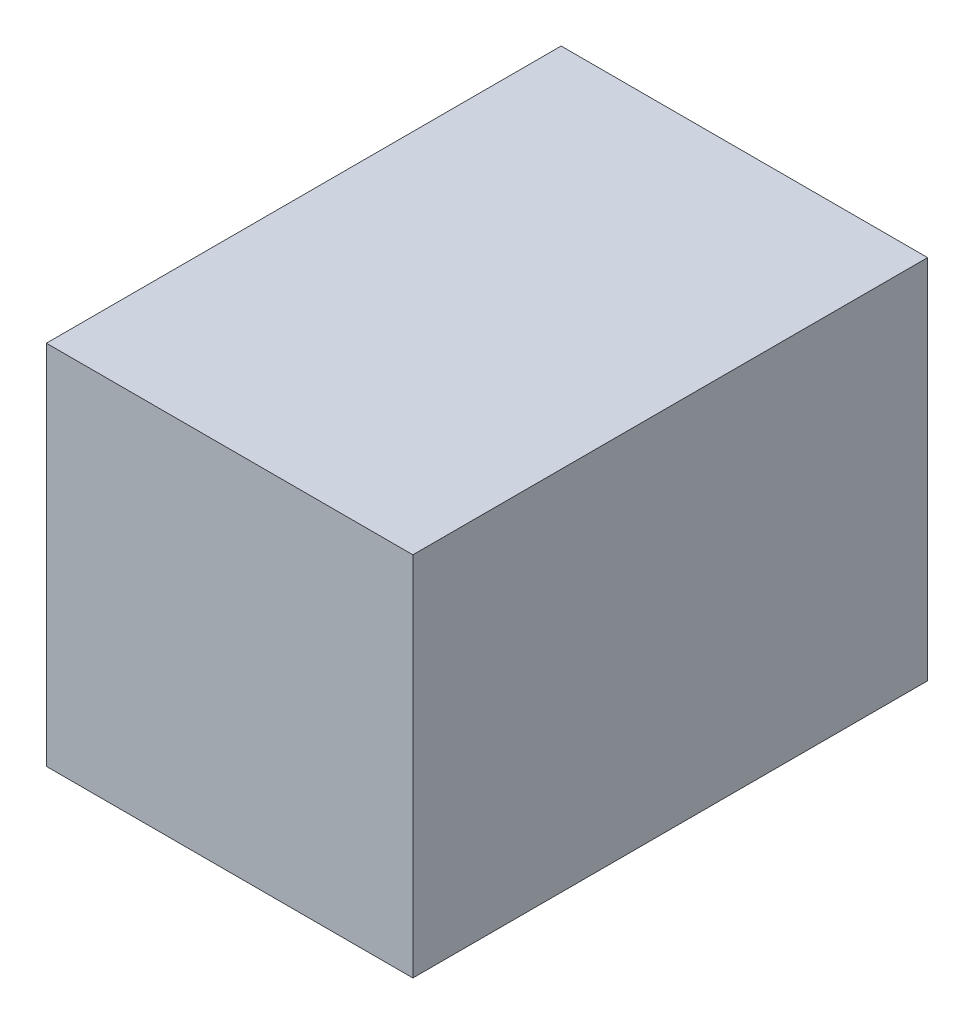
SolidWorks part; units mm, degrees
ref_plane "Front Plane" through (0, 0, 0) normal (0, 0, 1) x (1, 0, 0)
ref_plane "Top Plane" through (0, 0, 0) normal (0, 1, 0) x (1, 0, 0)
ref_plane "Right Plane" through (0, 0, 0) normal (1, 0, 0) x (0, 0, -1)
sketch "Sketch1" plane through (0, 0, 0) normal (0, 0, 1) x (1, 0, 0)
  line L1 (-71.2, -71.2) -> (71.2, -71.2)
  line L2 (-71.2, -71.2) -> (-71.2, 71.2)
  line L3 (-71.2, 71.2) -> (71.2, 71.2)
  line L4 (71.2, -71.2) -> (71.2, 71.2)
  line L5 (-71.2, -71.2) -> (71.2, 71.2) construction
  line L6 (-71.2, 71.2) -> (71.2, -71.2) construction
  point P0 (0, 0)
  dimension "D1" = 142.4
  dimension "D2" = 142.4
extrude "Boss-Extrude1" add sketch "Sketch1" along normal mid plane 200
other "Cavity1"
other "Model<1>@Interim Assembly1"
